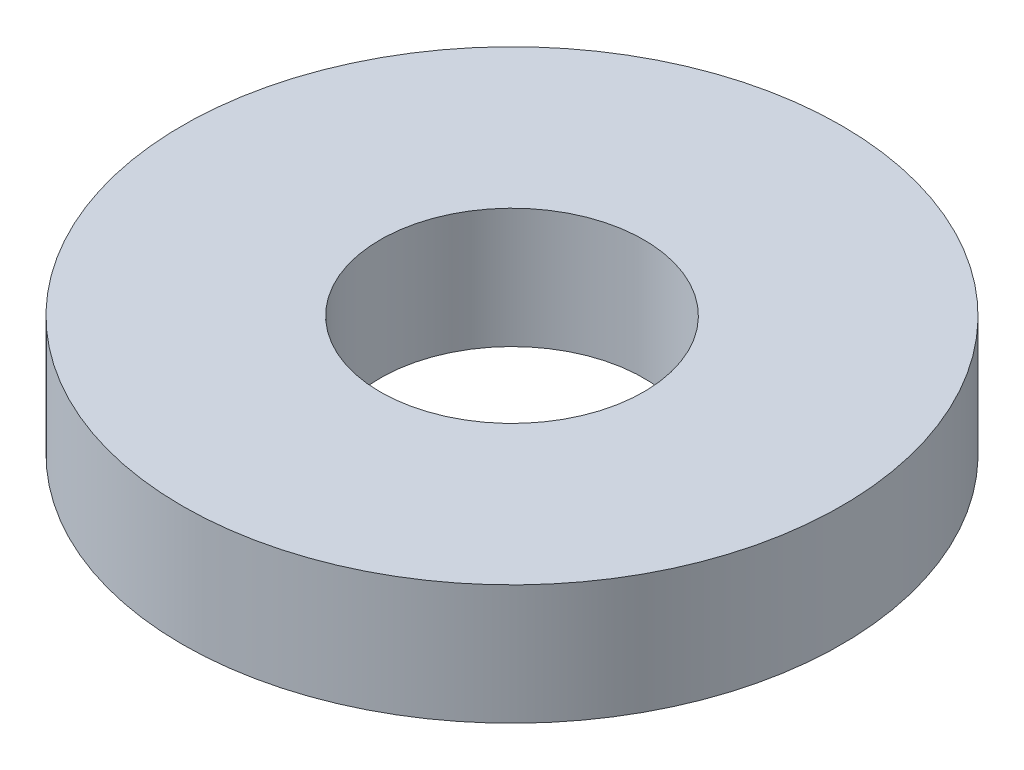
SolidWorks part; units mm, degrees
ref_plane "Front Plane" through (0, 0, 0) normal (0, 0, 1) x (1, 0, 0)
ref_plane "Top Plane" through (0, 0, 0) normal (0, 1, 0) x (1, 0, 0)
ref_plane "Right Plane" through (0, 0, 0) normal (1, 0, 0) x (0, 0, -1)
sketch "草图1" plane through (0, 0, 0) normal (0, 1, 0) x (1, 0, 0)
  circle A0 centre (0, 0) radius 2.75
extrude "凸台-拉伸1" add sketch "草图1" along normal blind 1
sketch "草图2" plane through (0, 1, 0) normal (0, 1, 0) x (1, 0, 0)
  circle A0 centre (0, 0) radius 1.1
extrude "切除-拉伸1" cut sketch "草图2" against normal blind 1
